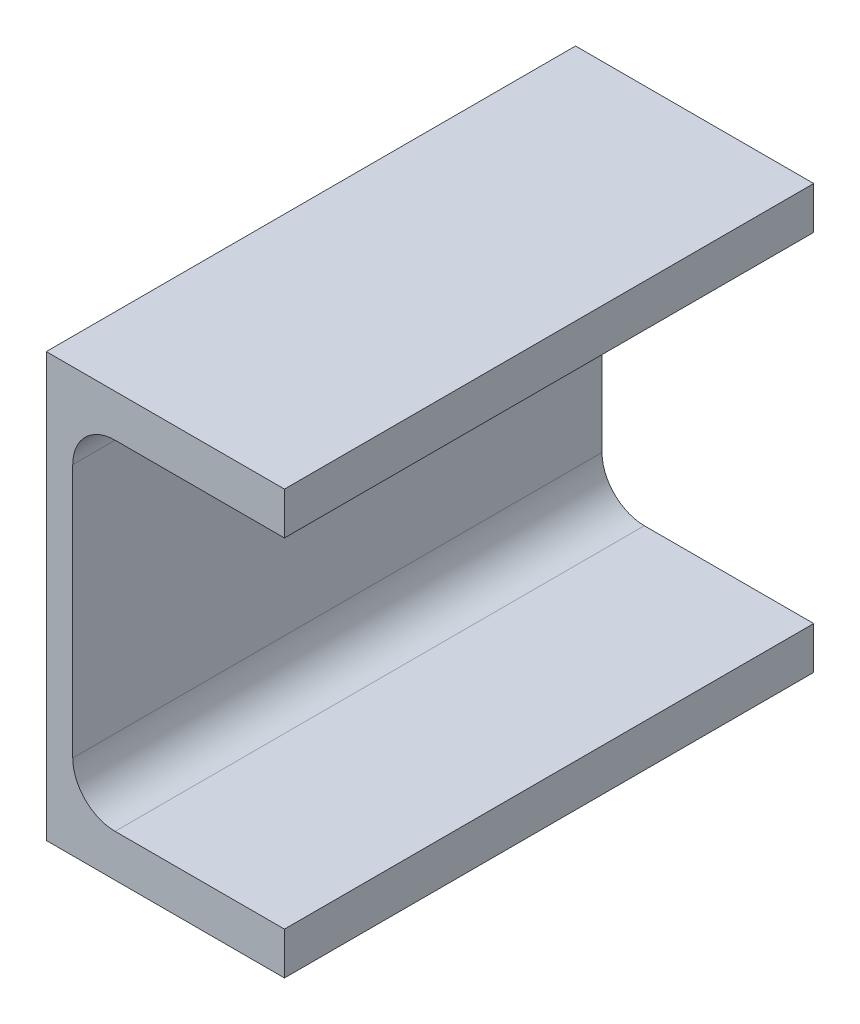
SolidWorks part; units mm, degrees
ref_plane "Front" through (0, 0, 0) normal (0, 0, 1) x (1, 0, 0)
ref_plane "Top" through (0, 0, 0) normal (0, 1, 0) x (1, 0, 0)
ref_plane "Right" through (0, 0, 0) normal (1, 0, 0) x (0, 0, -1)
sketch "Sketch1" plane through (0, 0, 0) normal (0, 0, 1) x (1, 0, 0)
  line L0 (45, 40) -> (0, 40)
  line L1 (45, -40) -> (0, -40)
  line L2 (0, 40) -> (0, -40)
  line L3 (45, 40) -> (45, 32)
  line L4 (45, -32) -> (45, -40)
  line L6 (5, 24) -> (5, -24)
  line L7 (13, 32) -> (45, 32)
  line L8 (13, -32) -> (45, -32)
  arc A0 (5, -24) -> (13, -32) centre (13, -24) ccw
  arc A1 (5, 24) -> (13, 32) centre (13, 24) cw
  point P14 (0, 0)
  dimension "D1" = 8
  dimension "Height" = 80
  dimension "Thickness" = 5
  dimension "Flange" = 8
  dimension "Width" = 45
extrude "Extrude1" add sketch "Sketch1" along normal mid plane 100
equation "\"D1@Sketch1\" = \"Flange@Sketch1\""
